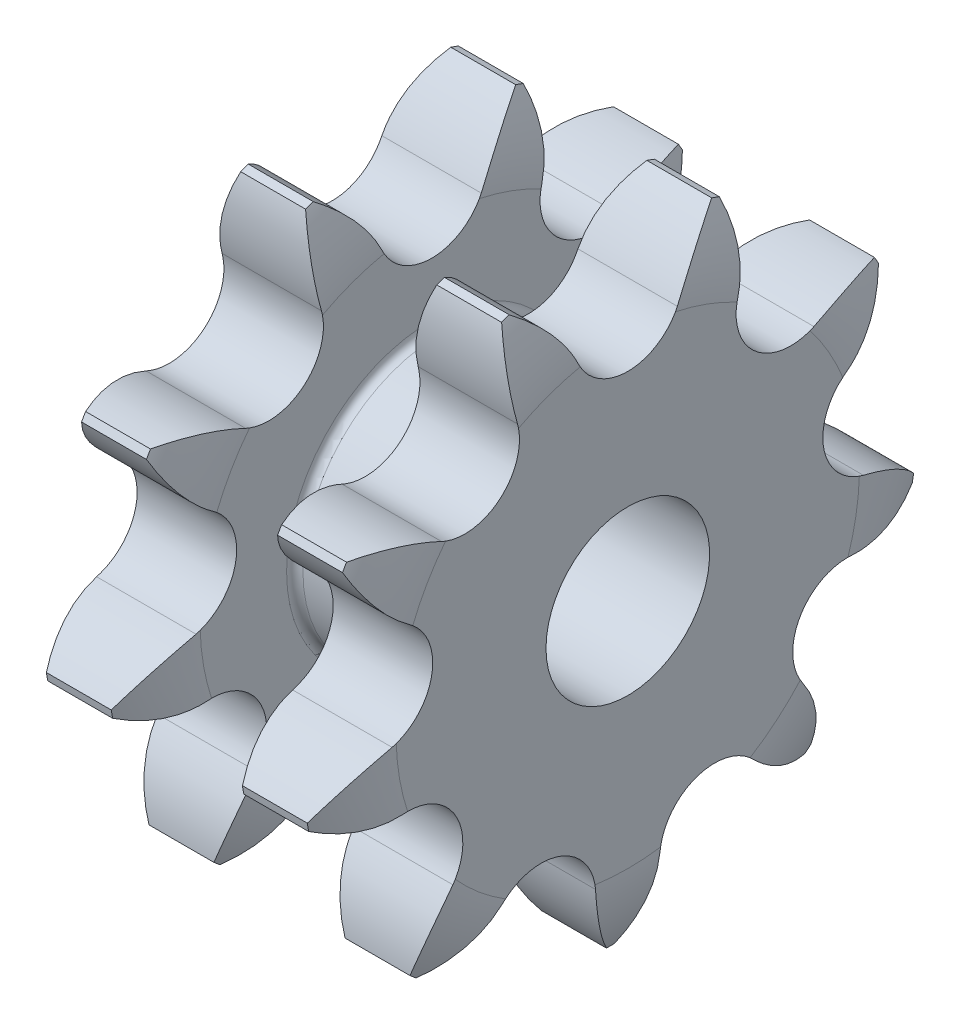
SolidWorks part; units mm, degrees
ref_plane "Plane1" through (0, 0, 0) normal (0, 0, 1) x (1, 0, 0)
ref_plane "Plane2" through (0, 0, 0) normal (0, 1, 0) x (1, 0, 0)
ref_plane "Plane3" through (0, 0, 0) normal (1, 0, 0) x (0, 0, -1)
sketch "Clipboard" plane through (0, 0, 0) normal (0, 1, 0) x (1, 0, 0)
  line L0 (0, 0) -> (12.5436, -1.9867)
  line L1 (-15, 0) -> (100, 0) construction
  line L2 (0, 0) -> (-0.8416, 0.9512)
  line L3 (0, 0) -> (-11.863, 4.5341)
  line L4 (0, 0) -> (3.0618, 0.4849)
  line L5 (0, 0) -> (-2.8109, -1.0484)
  line L6 (0, 0) -> (-17.9719, -12.1257)
  line L7 (-0.8416, 0.9512) -> (22.6002, 5.5078)
  line L8 (-76.2, 38.1) -> (-75.2, 38.1)
  line L9 (-73.4321, 41.7084) -> (-72.837, 41.7846)
  line L10 (-73.4741, 12.9512) -> (-59.0941, 12.9512)
  circle A0 centre (0, 0) radius 3.975
  circle A1 centre (0, 0) radius 10.0465
  circle A2 centre (0, 0) radius 25
  dimension "Dr" = 7.95
  dimension "MHD" = 20.093
  dimension "Hub_dia" = 50
  dimension "Num_teeth" = 9
  dimension "Pitch" = 12.7
  dimension "Width" = 3.1
  dimension "Side_relief" = 1.27
  dimension "Side_radius" = 12.7
  dimension "Overall_len" = 3
  dimension "Show_teeth" = 9
  dimension "Thickness" = 21.68
  dimension "OAL" = 23.8805
  dimension "T_dim" = 1
  dimension "Fillet_rad" = 0.6
  dimension "Face_width" = 7.3
  dimension "Num_strands" = 2
  dimension "Transv_pitch" = 14.38
  dimension "Plate_wid" = 12
sketch "BasProSke" plane through (0, 0, 0) normal (0, 1, 0) x (1, 0, 0)
  line L0 (-10, 0) -> (60, 0) construction
  line L1 (0, 0) -> (0, 16.9929)
  line L2 (0, 0) -> (21.68, 0)
  line L3 (21.68, 0) -> (21.68, 16.9929)
  line L4 (20.41, 22.5287) -> (1.27, 22.5287)
  arc A0 (0, 16.9929) -> (1.27, 22.5287) centre (12.7, 16.9929) cw
  arc A1 (21.68, 16.9929) -> (20.41, 22.5287) centre (8.98, 16.9929) ccw
  dimension "D1" = 12.7
  dimension "G1" = 1.27
  dimension "G2" = 1.27
  dimension "Diameter" = 45.0573
  dimension "Thickness" = 21.68
revolve "Base-Revolve" add sketch "BasProSke" angle 360 about L0
sketch "GrvSke" plane through (0, 0, 0) normal (0, 1, 0) x (1, 0, 0)
  line L0 (7.3, 16.9929) -> (7.3, 10.6465)
  line L1 (7.9, 10.0465) -> (13.78, 10.0465)
  line L2 (14.38, 10.6465) -> (14.38, 16.9929)
  line L3 (6.03, 22.5287) -> (15.65, 22.5287)
  line L4 (10.84, 0) -> (10.84, 52.07) construction
  line L5 (-10, 0) -> (60, 0) construction
  line L6 (0, 0) -> (35.56, 0) construction
  arc A0 (14.38, 16.9929) -> (15.65, 22.5287) centre (27.08, 16.9929) cw
  arc A1 (7.3, 16.9929) -> (6.03, 22.5287) centre (-5.4, 16.9929) ccw
  arc A2 (7.3, 10.6465) -> (7.9, 10.0465) centre (7.9, 10.6465) ccw
  arc A3 (13.78, 10.0465) -> (14.38, 10.6465) centre (13.78, 10.6465) ccw
  dimension "D1" = 12.7
  dimension "Fillet_rad" = 0.6
  dimension "Diameter" = 45.0573
  dimension "Grv_diam" = 20.093
  dimension "Grv_width" = 7.08
  dimension "Offset" = 10.84
  dimension "G1" = 1.27
revolve "Groove" cut sketch "GrvSke" angle 360 about L6
sketch "TooCutSke" plane through (0, 0, 0) normal (1, 0, 0) x (0, 0, -1)
  line L0 (0, 18.6059) -> (3.6386, 16.9092) construction
  line L1 (0, 0) -> (0, 107) construction
  line L2 (0, 18.6059) -> (-10, 18.6059) construction
  line L3 (0, 18.6059) -> (-3.6386, 16.9092) construction
  arc A0 (3.6386, 16.9092) -> (7.9748, 21.6037) centre (13.1494, 12.4742) cw
  arc A1 (3.6386, 16.9092) -> (-3.6386, 16.9092) centre (0, 18.6059) cw
  arc A2 (-3.6386, 16.9092) -> (-7.9748, 21.6037) centre (-13.1494, 12.4742) ccw
  arc A3 (7.9748, 21.6037) -> (-7.9748, 21.6037) centre (0, 0) ccw
  dimension "R1" = 4.0148
  dimension "R2" = 10.494
  dimension "Overcut" = 23.0287
  dimension "Seat_radius" = 18.6059
  dimension "X" = 130
extrude "ToothCut" cut sketch "TooCutSke" along normal through all
pattern_circular "TeethCuts" count 9 every 40 about axis through (-10, 0, 0) along (1, 0, 0) of "ToothCut"
sketch "HubNeaOneSke" plane through (0, 0, 0) normal (-1, 0, 0) x (0, 0, 1)
  circle A0 centre (0, 0) radius 10.0465
  dimension "Diameter" = 20.093
extrude "HubNearOne" [suppressed] add sketch "HubNeaOneSke" along normal blind 2.2005
fillet "HubNearOneFillet" [suppressed] radius 0.6
sketch "HubNeaBotSke" plane through (0, 0, 0) normal (-1, 0, 0) x (0, 0, 1)
  circle A0 centre (0, 0) radius 10.0465
  dimension "Diameter" = 20.093
extrude "HubNearBoth" [suppressed] add sketch "HubNeaBotSke" along normal blind 1.1003
fillet "HubNearBothFillet" [suppressed] radius 0.6
ref_plane "FarPln" through (21.68, 0, 0) normal (1, 0, 0) x (0, 0, -1)
sketch "HubFarSke" plane through (21.68, 0, 0) normal (1, 0, 0) x (0, 0, -1)
  circle A0 centre (0, 0) radius 10.0465
  dimension "Diameter" = 20.093
extrude "HubFar" [suppressed] add sketch "HubFarSke" along normal blind 1.1003
fillet "HubFarFillet" [suppressed] radius 0.6
sketch "BorSke" plane through (0, 0, 0) normal (1, 0, 0) x (0, 0, -1)
  circle A0 centre (0, 0) radius 6
  dimension "Diameter" = 12
extrude "Bore" cut sketch "BorSke" along normal mid plane 47.761
sketch "KeySke" plane through (0, 0, 0) normal (1, 0, 0) x (0, 0, -1)
  line L0 (-1, 0) -> (-1, 7)
  line L1 (-1, 7) -> (1, 7)
  line L2 (1, 7) -> (1, 0)
  line L3 (0, 0) -> (0, 34) construction
  line L4 (-1, 0) -> (1, 0)
  dimension "Offset" = 7
  dimension "Width" = 2
extrude "Keyway" [suppressed] cut sketch "KeySke" along normal mid plane 47.761
pattern_circular "Keyway2" [suppressed] count 2 every 90 about axis through (-10, 0, 0) along (1, 0, 0)
equation "' \"Pitch@Clipboard\" = 12.7"
equation "' \"Num_strands@Clipboard\" = 2"
equation "' \"Num_teeth@Clipboard\" = 9"
equation "' \"Hub_dia@Clipboard\" = 50"
equation "' \"Overall_len@Clipboard\" = 3"
equation "' \"Diameter@BorSke\" = 12"
equation "' \"T_dim@Clipboard\" = 1"
equation "' \"Width@KeySke\" = 2"
equation "' \"Dr@Clipboard\" = 7.95"
equation "' \"Face_width@Clipboard\" = 7.3"
equation "' \"Side_radius@Clipboard\" = 12.7"
equation "' \"Side_relief@Clipboard\" = 1.27"
equation "' \"Transv_pitch@Clipboard\" = 14.38"
equation "' \"Show_teeth@Clipboard\" = 9"
equation "' \"Fillet_rad@Clipboard\" = 0.6"
equation "' \"Plate_wid@Clipboard\" = 12"
equation "\"Num_teeth@Clipboard\" = int( \"Num_teeth@Clipboard\" )"
equation "\"Num_teeth@Clipboard\" = ((sgn( \"Num_teeth@Clipboard\" - 5.0)+1)*( \"Num_teeth@Clipboard\" - 5.0))/2 +5.0"
equation "\"Num_teeth@Clipboard\" = ((sgn( \"Num_teeth@Clipboard\" - 200.0)-1)*( \"Num_teeth@Clipboard\" - 200.0))/-2 +200.0"
equation "\"MHD@Clipboard\" = \"Pitch@Clipboard\" * (1.0 / tan(3.14159265 / \"Num_teeth@Clipboard\" )) - 1.05 * \"Plate_wid@Clipboard\" - 2.0 * \"Fillet_rad@Clipboard\" - 1.0"
equation "\"Thickness@Clipboard\"  = \"Face_width@Clipboard\" + (\"Num_strands@Clipboard\" - 1) * \"Transv_pitch@Clipboard\""
equation "\"OAL@Clipboard\" = \"Thickness@Clipboard\" + 2 * \"Fillet_rad@Clipboard\" + 1"
equation "\"MHD@Clipboard\" = ((sgn( \"MHD@Clipboard\" - \"Hub_dia@Clipboard\" )-1)*( \"MHD@Clipboard\" - \"Hub_dia@Clipboard\" ))/-2+ \"Hub_dia@Clipboard\""
equation "\"OAL@Clipboard\" = ((sgn( \"OAL@Clipboard\" - \"Overall_len@Clipboard\" )+1)*( \"OAL@Clipboard\" - \"Overall_len@Clipboard\" ))/2 + \"Overall_len@Clipboard\" + 0.0005"
equation "\"Num_teeth@TeethCuts\" = int( \"Show_teeth@Clipboard\" ) + 1"
equation "\"Num_teeth@TeethCuts\" = ((sgn( \"Num_teeth@TeethCuts\" - \"Num_teeth@Clipboard\" )-1)*( \"Num_teeth@TeethCuts\" - \"Num_teeth@Clipboard\" ))/-2+ \"Num_teeth@Clipboard\""
equation "\"Num_teeth@TeethCuts\" = ((sgn( \"Num_teeth@TeethCuts\" - 2.0)+1)*( \"Num_teeth@TeethCuts\" - 2.0))/2 +2.0"
equation "\"Angle@TeethCuts\" = 360.0 / \"Num_teeth@Clipboard\""
equation "\"Seat_radius@TooCutSke\" = ( \"Pitch@Clipboard\" / 2.0) / sin(3.14159265 / \"Num_teeth@Clipboard\" ) - \"Dr@Clipboard\" / 2.0 + \"Dr@Clipboard\" * 0.505"
equation "\"R1@TooCutSke\"  = \"Dr@Clipboard\" * 0.505"
equation "\"X@TooCutSke\" = 140.0 - (90.0 / \"Num_teeth@Clipboard\")"
equation "\"R2@TooCutSke\" = 0.12 * \"Dr@Clipboard\" * ( \"Num_teeth@Clipboard\" + 2.0)"
equation "\"Overcut@TooCutSke\" = 0.5 + 0.625 * \"Pitch@Clipboard\" - 0.5 * \"Dr@Clipboard\"  +  \"Pitch@Clipboard\" / 2.0 / sin(3.14159265 / \"Num_teeth@Clipboard\" )"
equation "\"Diameter@BasProSke\" = 2.0 * ( 0.625 * \"Pitch@Clipboard\" - 0.5 * \"Dr@Clipboard\"  +  \"Pitch@Clipboard\" / 2.0 / sin(3.14159265 / \"Num_teeth@Clipboard\" ))"
equation "\"Thickness@BasProSke\"  = \"Thickness@Clipboard\""
equation "\"G1@BasProSke\" =  \"Side_relief@Clipboard\""
equation "\"G2@BasProSke\" =  \"Side_relief@Clipboard\""
equation "\"D1@BasProSke\" =  \"Side_radius@Clipboard\""
equation "\"Diameter@GrvSke\" = \"Diameter@BasProSke\""
equation "\"G1@GrvSke\" = \"Side_relief@Clipboard\""
equation "\"D1@GrvSke\" = \"Side_radius@Clipboard\""
equation "\"Grv_diam@GrvSke\" =  \"Pitch@Clipboard\" * (1.0 / tan(3.14159265 / \"Num_teeth@Clipboard\" ))- 1.05 * \"Plate_wid@Clipboard\" - 2.0 * \"Fillet_rad@Clipboard\" - 1.0"
equation "\"Grv_width@GrvSke\" =  \"Transv_pitch@Clipboard\" - \"Face_width@Clipboard\""
equation "\"Offset@GrvSke\" = \"Grv_width@GrvSke\" / 2.0 + \"Face_width@Clipboard\""
equation "\"Fillet_rad@GrvSke\" = \"Fillet_rad@Clipboard\""
equation "\"Diameter@HubNeaOneSke\" = \"MHD@Clipboard\""
equation "\"Length@HubNearOne\" = \"OAL@Clipboard\" - \"Thickness@BasProSke\""
equation "\"Diameter@HubNeaBotSke\" = \"MHD@Clipboard\""
equation "\"Length@HubNearBoth\" = ( \"OAL@Clipboard\" - \"Thickness@BasProSke\" ) / 2.0"
equation "\"D1@HubNearOneFillet\" = \"Fillet_rad@Clipboard\""
equation "\"D1@HubNearBothFillet\" = \"Fillet_rad@Clipboard\""
equation "\"Thickness@FarPln\" = \"Thickness@BasProSke\""
equation "\"Diameter@HubFarSke\" = \"MHD@Clipboard\""
equation "\"Length@HubFar\" = ( \"OAL@Clipboard\" - \"Thickness@BasProSke\" ) / 2.0"
equation "\"D1@HubFarFillet\" = \"Fillet_rad@Clipboard\""
equation "\"D1@Bore\" = \"OAL@Clipboard\" * 2.0"
equation "\"D1@Keyway\" = \"OAL@Clipboard\" * 2.0"
equation "\"Offset@KeySke\" = \"T_dim@Clipboard\" + \"Diameter@BorSke\" / 2.0"
